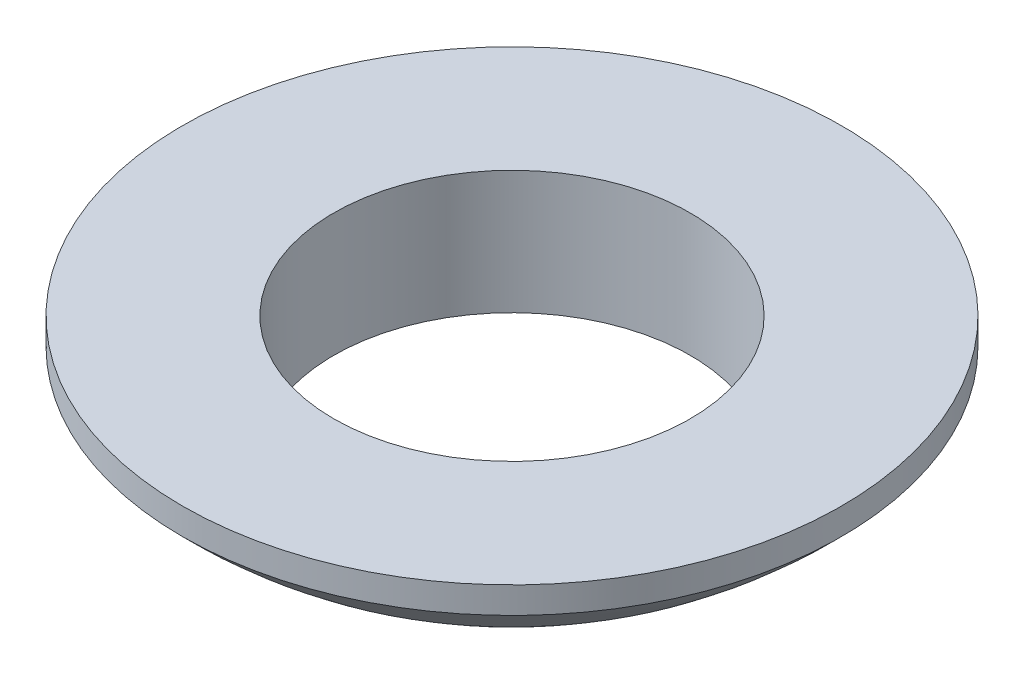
SolidWorks part; units mm, degrees
ref_plane "Plan1" through (0, 0, 0) normal (0, 0, 1) x (1, 0, 0)
ref_plane "Plan2" through (0, 0, 0) normal (0, 1, 0) x (1, 0, 0)
ref_plane "Plan3" through (0, 0, 0) normal (1, 0, 0) x (0, 0, -1)
sketch "Esquisse2" plane through (0, 0, 0) normal (0, 0, 1) x (1, 0, 0)
  line L0 (474.9402, 265.5785) -> (474.9402, 248.3133) construction
  line L1 (468.5802, 263.5084) -> (468.5802, 267.9084)
  line L2 (463.1862, 267.9084) -> (468.5802, 267.9084)
  line L3 (463.1862, 267.9084) -> (463.1862, 266.964)
  line L5 (467.9789, 263.5084) -> (468.5802, 263.5084)
  arc A0 (467.9789, 263.5084) -> (463.1862, 266.964) centre (474.9402, 278.2147) cw
  dimension "D1" = 4.4
  dimension "D2" = 6.36
revolve "Base-Révolution" add sketch "Esquisse2" angle 360 about L0
